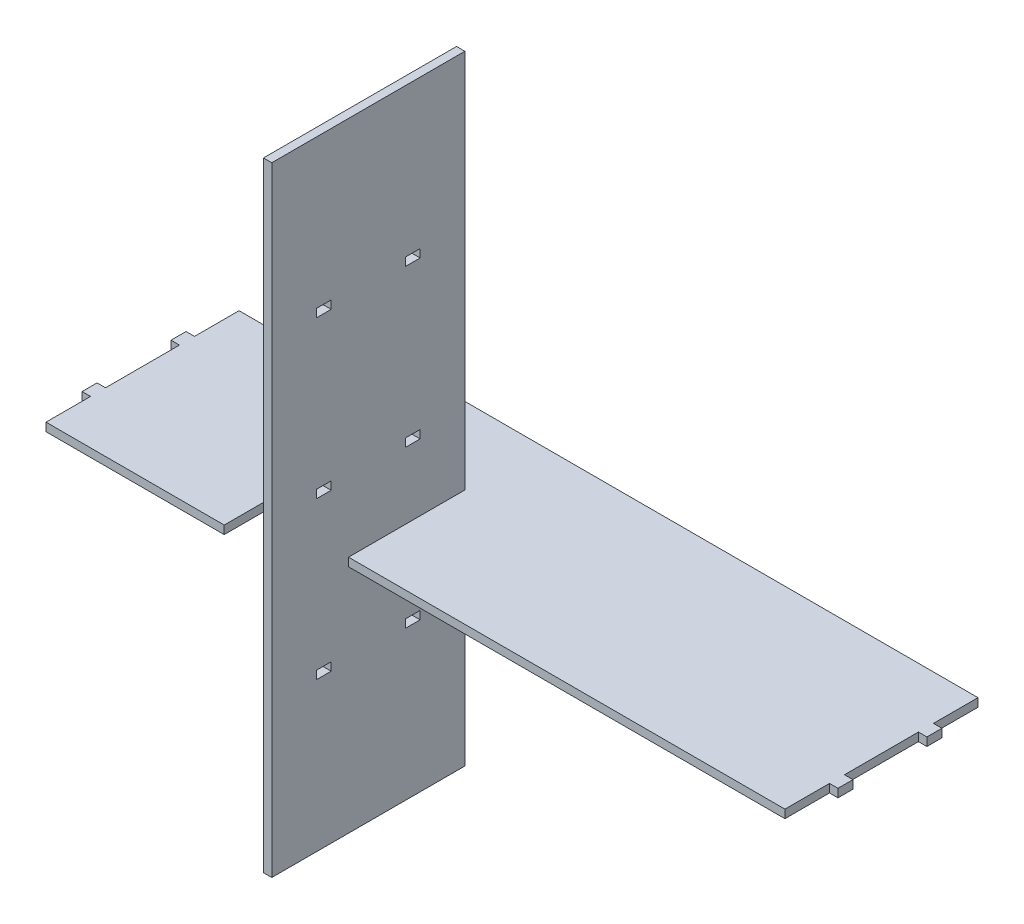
SolidWorks part; units mm, degrees
ref_plane "Piano frontale" through (0, 0, 0) normal (0, 0, 1) x (1, 0, 0)
ref_plane "Piano superiore" through (0, 0, 0) normal (0, 1, 0) x (1, 0, 0)
ref_plane "Piano destro" through (0, 0, 0) normal (1, 0, 0) x (0, 0, -1)
sketch "Schizzo1" plane through (0, 0, 0) normal (0, 1, 0) x (1, 0, 0)
  line L0 (-42.3626, 13.299) -> (-42.3626, -7.8971)
  line L1 (-42.3626, -7.8971) -> (-34.2026, -7.8971)
  line L2 (-34.2026, -7.8971) -> (-34.2026, -2.1143)
  line L3 (-34.2026, -2.1143) -> (-28.5026, -2.1143)
  line L4 (-28.5026, -2.1143) -> (-28.5026, 7.9857)
  line L5 (-28.5026, 7.9857) -> (-34.2026, 7.9857)
  line L6 (-34.2026, 7.9857) -> (-34.2026, 13.299)
  line L7 (-34.2026, 13.299) -> (-42.3626, 13.299)
  line L8 (-55.577, 13.3989) -> (-43.3369, 13.3989)
  line L9 (-55.577, -7.8011) -> (-43.3369, -7.8011)
  line L10 (-55.577, -7.8011) -> (-55.577, -2.0183)
  line L11 (-55.577, -2.0183) -> (-50.077, -2.0183)
  line L12 (-50.077, -2.0183) -> (-50.077, 7.7817)
  line L13 (-50.077, 7.7817) -> (-55.577, 7.7817)
  line L14 (-55.577, 7.7817) -> (-55.577, 13.3989)
  line L15 (-43.3369, -7.8011) -> (-43.3369, 13.3989)
  line L16 (-215.4988, 26.8713) -> (-215.4988, 5.1281)
  line L17 (-215.4988, 5.1281) -> (-197.8446, 5.1469)
  line L18 (-209.7983, 10.5043) -> (-209.7983, 20.4043)
  line L19 (-209.7983, 20.4043) -> (-204.2983, 20.4043)
  line L20 (-204.2983, 10.5043) -> (-204.2983, 20.4043)
  line L21 (-215.4988, 26.8713) -> (-197.8446, 26.8713)
  line L22 (-197.8446, 26.8713) -> (-197.8446, 5.1469)
  line L29 (-209.7983, 10.5043) -> (-204.2983, 10.5043)
sketch "Schizzo2" plane through (0, 0, 0) normal (0, 1, 0) x (1, 0, 0)
  line L0 (22.8338, 13.8944) -> (22.8338, -7.0859)
  line L1 (22.8338, -7.0859) -> (39.8687, -7.0678)
  line L2 (28.3344, -1.8019) -> (28.3344, 8.0981)
  line L3 (28.3344, 8.0981) -> (33.8344, 8.0981)
  line L4 (33.8344, -1.8019) -> (33.8344, 8.0981)
  line L5 (22.8338, 13.8944) -> (39.8687, 13.8944)
  line L6 (39.8687, 13.8944) -> (39.8687, -7.0678)
  line L7 (28.3344, -1.8019) -> (33.8344, -1.8019)
  line L8 (8.3997, 13.5093) -> (8.3997, -7.6868)
  line L9 (8.3997, -7.6868) -> (16.5597, -7.6868)
  line L10 (16.5597, -7.6868) -> (16.5597, -1.904)
  line L11 (16.5597, -1.904) -> (22.2597, -1.904)
  line L12 (22.2597, -1.904) -> (22.2597, 8.196)
  line L13 (22.2597, 8.196) -> (16.5597, 8.196)
  line L14 (16.5597, 8.196) -> (16.5597, 13.5093)
  line L15 (16.5597, 13.5093) -> (8.3997, 13.5093)
sketch "Schizzo3" plane through (0, 0, 0) normal (0, 1, 0) x (1, 0, 0)
  line L1 (-22.952, 18.4276) -> (-6.4981, 18.4276)
  line L2 (-22.952, 18.4276) -> (-22.952, -34.1226)
  line L3 (-22.952, -34.1226) -> (-6.4981, -34.1226)
  line L4 (-6.4981, 18.4276) -> (-6.4981, -34.1226)
sketch "Schizzo4" plane through (0, 0, 0) normal (1, 0, 0) x (0, 0, -1)
  line L0 (-3.5798, 161.4632) -> (6.3202, 161.4632)
  line L1 (-93.5798, 261.4632) -> (36.4202, 261.4632)
  line L2 (-93.5798, 261.4632) -> (-93.5798, -155.3708)
  line L4 (36.4202, 261.4632) -> (36.4202, -155.3708)
  line L5 (-63.4798, 161.4632) -> (-53.5798, 161.4632)
  line L6 (-63.4798, 161.4632) -> (-63.4798, 155.9632)
  line L7 (-63.4798, 155.9632) -> (-53.5798, 155.9632)
  line L8 (-53.5798, 161.4632) -> (-53.5798, 155.9632)
  line L9 (-3.5798, 161.4632) -> (-3.5798, 155.9632)
  line L10 (-3.5798, 155.9632) -> (6.3202, 155.9632)
  line L11 (6.3202, 161.4632) -> (6.3202, 155.9632)
  line L12 (-3.5798, 55.9632) -> (6.3202, 55.9632)
  line L13 (-63.4798, 55.9632) -> (-53.5798, 55.9632)
  line L14 (-63.4798, 55.9632) -> (-63.4798, 50.4632)
  line L15 (-63.4798, 50.4632) -> (-53.5798, 50.4632)
  line L16 (-53.5798, 55.9632) -> (-53.5798, 50.4632)
  line L17 (-3.5798, 55.9632) -> (-3.5798, 50.4632)
  line L18 (-3.5798, 50.4632) -> (6.3202, 50.4632)
  line L19 (6.3202, 55.9632) -> (6.3202, 50.4632)
  line L20 (-3.5798, -49.5368) -> (6.3202, -49.5368)
  line L21 (-63.4798, -49.5368) -> (-53.5798, -49.5368)
  line L22 (-63.4798, -49.5368) -> (-63.4798, -55.0368)
  line L23 (-63.4798, -55.0368) -> (-53.5798, -55.0368)
  line L24 (-53.5798, -49.5368) -> (-53.5798, -55.0368)
  line L25 (-3.5798, -49.5368) -> (-3.5798, -55.0368)
  line L26 (-3.5798, -55.0368) -> (6.3202, -55.0368)
  line L27 (6.3202, -49.5368) -> (6.3202, -55.0368)
  line L28 (-93.5798, -155.3708) -> (36.4202, -155.3708)
  point P12 (-58.5298, 161.4632)
extrude "Estrusione-Estrusione1" add sketch "Schizzo4" along normal blind 5.6
sketch "Schizzo5" plane through (0, 0, 0) normal (0, 1, 0) x (1, 0, 0)
  line L0 (-50.5576, -11.8814) -> (-56.2576, -11.8814)
  line L1 (-50.5576, 88.1186) -> (299.4424, 88.1186)
  line L2 (-50.5576, 88.1186) -> (-50.5576, 58.1186)
  line L3 (-50.5576, -41.8814) -> (299.4424, -41.8814)
  line L4 (299.4424, -11.8814) -> (299.4424, -41.8814)
  line L5 (-56.2576, -11.8814) -> (-56.2576, -1.7814)
  line L6 (-56.2576, -1.7814) -> (-50.5576, -1.7814)
  line L7 (-50.5576, -11.8814) -> (-50.5576, -41.8814)
  line L8 (-50.5576, 58.1186) -> (-56.2576, 58.1186)
  line L9 (-56.2576, 58.1186) -> (-56.2576, 48.0186)
  line L10 (-56.2576, 48.0186) -> (-50.5576, 48.0186)
  line L11 (-50.5576, 48.0186) -> (-50.5576, -1.7814)
  line L13 (299.4424, 88.1186) -> (299.4424, 58.1186)
  line L16 (305.1424, 48.0186) -> (299.4424, 48.0186)
  line L17 (305.1424, 58.1186) -> (305.1424, 48.0186)
  line L18 (299.4424, 58.1186) -> (305.1424, 58.1186)
  line L19 (305.1424, -1.7814) -> (299.4424, -1.7814)
  line L20 (305.1424, -11.8814) -> (305.1424, -1.7814)
  line L21 (299.4424, -11.8814) -> (305.1424, -11.8814)
  line L22 (299.4424, 48.0186) -> (299.4424, -1.7814)
  point P12 (-56.2576, 53.0686)
  point P13 (-56.2576, -6.8314)
extrude "Estrusione-Estrusione2" add sketch "Schizzo5" along normal blind 5.6 separate body
sketch "Schizzo6" plane through (0, 0, 0) normal (0, 1, 0) x (1, 0, 0)
  line L0 (-175, -35) -> (-180.7, -35)
  line L1 (-175, 65) -> (-55, 65)
  line L2 (-175, 65) -> (-175, 35)
  line L3 (-175, -65) -> (-55, -65)
  line L5 (-180.7, -35) -> (-180.7, -24.9)
  line L6 (-180.7, -24.9) -> (-175, -24.9)
  line L7 (-175, -35) -> (-175, -65)
  line L8 (-175, 35) -> (-180.7, 35)
  line L9 (-180.7, 35) -> (-180.7, 24.9)
  line L10 (-180.7, 24.9) -> (-175, 24.9)
  line L11 (-175, 24.9) -> (-175, -24.9)
  line L20 (-55, 65) -> (-55, -65)
  point P12 (-180.7, 29.95)
  point P13 (-180.7, -29.95)
  dimension "D1" = 120
  dimension "D2" = 5.7
  dimension "D3" = 5.7
  dimension "D4" = 10.1
  dimension "D5" = 10.1
  dimension "D6" = 5.7
  dimension "D7" = 59.9
  dimension "D8" = 30
  dimension "D9" = 30
extrude "Estrusione-Estrusione3" add sketch "Schizzo6" along normal blind 5.6 separate body
equation "\"k\"= 0.1mm'kerf"
equation "\"m\"= 5.6mm'material thickness"
equation "\"tf\"= \"m\" - \"k\"'female thickness"
equation "\"tm\"= \"m\" + \"k\"'male thickness"
equation "\"j\"= 10mm'joint"
equation "\"jf\"= \"j\" - \"k\"'female joint"
equation "\"jm\"= \"j\" + \"k\"'male joint"
equation "\"D1@Schizzo1\"=\"jm\""
equation "\"D2@Schizzo1\"=\"tm\""
equation "\"D3@Schizzo1\"=\"tm\""
equation "\"D9@Schizzo1\"=\"tf\""
equation "\"D10@Schizzo1\"=\"tf\""
equation "\"D11@Schizzo1\"=\"jf\""
equation "\"D1@Schizzo2\"=\"tf\""
equation "\"D6@Schizzo2\"=\"jf\""
equation "\"D3@Schizzo2\"=\"tm\""
equation "\"D4@Schizzo2\"=\"tm\""
equation "\"D2@Schizzo2\"=\"jm\""
equation "\"D4@Schizzo4\"=\"jf\""
equation "\"D5@Schizzo4\"=\"tf\""
equation "\"D3@Schizzo5\"=\"tm\""
equation "\"D4@Schizzo5\"=\"tm\""
equation "\"D5@Schizzo5\"=\"jm\""
equation "\"D2@Schizzo5\"=\"jm\""
equation "\"D6@Schizzo5\"=\"tm\""
